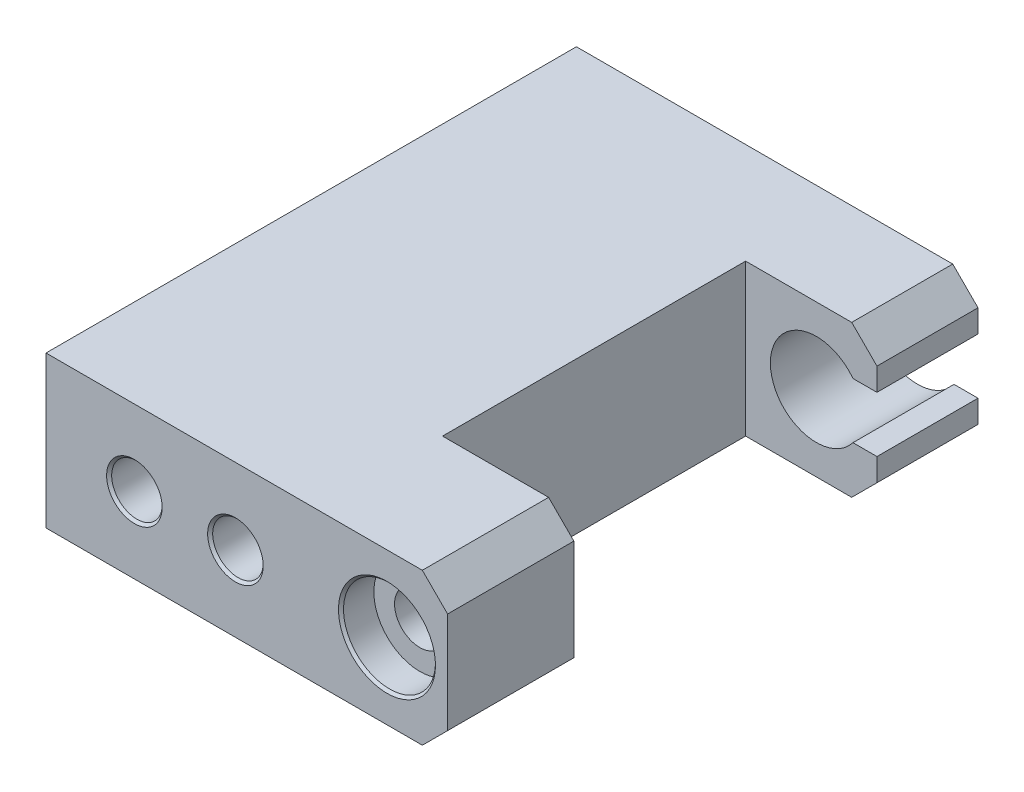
SolidWorks part; units mm, degrees
ref_plane "Plan1" through (0, 0, 0) normal (0, 0, 1) x (1, 0, 0)
ref_plane "Plan2" through (0, 0, 0) normal (0, 1, 0) x (1, 0, 0)
ref_plane "Plan3" through (0, 0, 0) normal (1, 0, 0) x (0, 0, -1)
sketch "Esquisse1" plane through (0, 0, 0) normal (0, 0, 1) x (1, 0, 0)
  line L0 (0, 0) -> (80, 0)
  line L1 (80, 0) -> (80, 30)
  line L2 (80, 30) -> (0, 30)
  line L3 (0, 30) -> (0, 0)
  dimension "D1" = 80
  dimension "D2" = 30
extrude "Base-Extrusion" add sketch "Esquisse1" along normal blind 105
chamfer "Chanfrein1" distance 5 angle 45
ref_plane "Plan4" through (0, 0, 20) normal (0, 0, 1) x (1, 0, 0)
sketch "Esquisse2" plane through (0, 0, 20) normal (0, 0, 1) x (1, 0, 0)
  line L0 (54, 40) -> (54, -10)
  line L1 (54, 40) -> (84, 40)
  line L2 (84, 40) -> (84, -10)
  line L3 (84, -10) -> (54, -10)
  line L4 (80, 0) -> (80, 30) construction
  line L5 (20, 15) -> (60, 15) construction
  line L6 (0, 0) -> (75, 0) construction
  line L7 (68, 20) -> (68, -10) construction
  line L8 (80, 5) -> (80, 25) construction
  dimension "D4" = 30
  dimension "D1" = 26
  dimension "D2" = 15
  dimension "D3" = 12
  dimension "D5" = 50
  dimension "D6" = 25
extrude "Enlèv. mat.-Extru.1" cut sketch "Esquisse2" along normal blind 60
sketch "Esquisse6" plane through (0, 0, 0) normal (0, 0, 1) x (1, 0, 0)
  line L0 (20, 15) -> (60, 15) construction
  circle A0 centre (68, 15) radius 9.1
  dimension "D1" = 18.2
  dimension "D2" = 68
extrude "Enlèv. mat.-Extru.6" cut sketch "Esquisse6" along normal blind 20
sketch "Esquisse7" plane through (0, 0, 0) normal (0, 0, 1) x (1, 0, 0)
  line L0 (58.9, 15) -> (77.1, 15) construction
  line L1 (73, 20.5) -> (83, 20.5)
  line L3 (73, 9.5) -> (83, 9.5)
  line L5 (83, 9.5) -> (83, 20.5)
  line L6 (73, 9.5) -> (73, 20.5)
  line L7 (68, 5.9) -> (68, 24.1) construction
  circle A1 centre (68, 15) radius 9.1 construction
  dimension "D1" = 5.5
  dimension "D2" = 11
  dimension "D3" = 5
  dimension "D4" = 10
extrude "Enlèv. mat.-Extru.8" cut sketch "Esquisse7" along normal up to next
ref_plane "Plan5" through (0, 0, 105) normal (0, 0, -1) x (-1, 0, 0)
sketch "Esquisse8" plane through (0, 0, 105) normal (0, 0, -1) x (-1, 0, 0)
  circle A0 centre (-68, 15) radius 5
  dimension "D1" = 10
extrude "Enlèv. mat.-Extru.10" cut sketch "Esquisse8" along normal up to next
sketch "Esquisse9" plane through (0, 0, 105) normal (0, 0, -1) x (-1, 0, 0)
  circle A0 centre (-68, 15) radius 9.1
  dimension "D1" = 18.2
extrude "Enlèv. mat.-Extru.11" cut sketch "Esquisse9" along normal blind 6.5
sketch "Esquisse10" plane through (0, 0, 105) normal (0, 0, -1) x (-1, 0, 0)
  line L0 (-68, 15) -> (3, 15) construction
  line L1 (-18, 22) -> (-18, -3) construction
  line L2 (-38, 25) -> (-38, -4) construction
  circle A0 centre (-38, 15) radius 5
  circle A1 centre (-18, 15) radius 5
  dimension "D3" = 10
  dimension "D4" = 10
  dimension "D1" = 30
  dimension "D2" = 20
extrude "Enlèv. mat.-Extru.12" cut sketch "Esquisse10" along normal blind 30
chamfer "Chanfrein2" distance 0.5 angle 45
